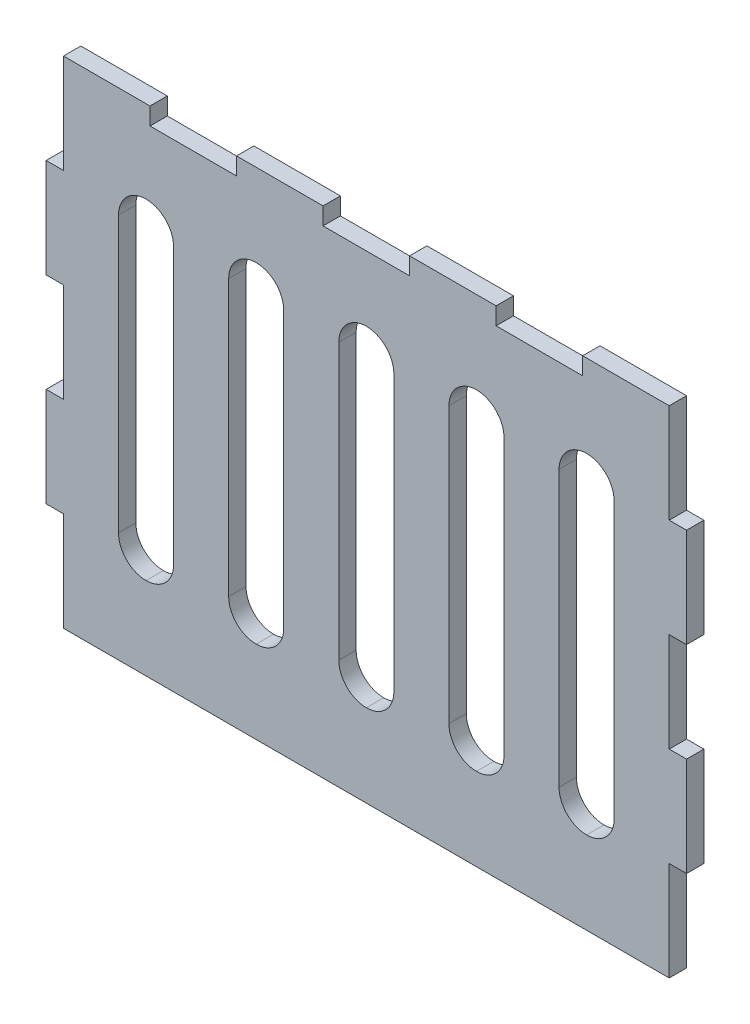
SolidWorks part; units mm, degrees
ref_plane "Front Plane" through (0, 0, 0) normal (0, 0, 1) x (1, 0, 0)
ref_plane "Top Plane" through (0, 0, 0) normal (0, 1, 0) x (1, 0, 0)
ref_plane "Right Plane" through (0, 0, 0) normal (1, 0, 0) x (0, 0, -1)
sketch "Sketch1" plane through (0, 0, 0) normal (0, 0, 1) x (1, 0, 0)
  line L0 (-391.1979, -45.72) -> (-391.1979, -137.16)
  line L1 (-375.1979, 228.6) -> (-295.3693, 228.6)
  line L2 (-375.1979, 228.6) -> (-375.1979, 137.16)
  line L3 (-375.1979, -228.6) -> (183.6021, -228.6)
  line L4 (183.6021, 228.6) -> (183.6021, 137.16)
  line L5 (-375.1979, 0) -> (183.6021, 0) construction
  line L6 (-171.9979, -152.4) -> (-171.9979, 152.4)
  line L7 (-375.1979, 137.16) -> (-391.1979, 137.16)
  line L8 (-375.1979, -137.16) -> (-375.1979, -228.6)
  line L9 (-375.1979, 45.72) -> (-391.1979, 45.72)
  line L10 (-391.1979, 137.16) -> (-391.1979, 45.72)
  line L11 (-375.1979, -45.72) -> (-391.1979, -45.72)
  line L12 (-375.1979, -137.16) -> (-391.1979, -137.16)
  line L13 (-375.1979, 45.72) -> (-375.1979, -45.72)
  line L14 (-324.3979, -152.4) -> (-273.5979, -152.4)
  line L15 (199.6021, -45.72) -> (199.6021, -137.16)
  line L16 (183.6021, -137.16) -> (199.6021, -137.16)
  line L17 (183.6021, -45.72) -> (199.6021, -45.72)
  line L18 (183.6021, 45.72) -> (199.6021, 45.72)
  line L19 (183.6021, 137.16) -> (199.6021, 137.16)
  line L20 (199.6021, 137.16) -> (199.6021, 45.72)
  line L21 (183.6021, 45.72) -> (183.6021, -45.72)
  line L22 (183.6021, -137.16) -> (183.6021, -228.6)
  line L23 (-135.7122, 228.6) -> (-135.7122, 212.6)
  line L24 (-55.8836, 228.6) -> (23.945, 228.6)
  line L25 (-295.3693, 228.6) -> (-295.3693, 212.6)
  line L26 (-295.3693, 212.6) -> (-215.5407, 212.6)
  line L27 (-215.5407, 228.6) -> (-215.5407, 212.6)
  line L28 (-55.8836, 228.6) -> (-55.8836, 212.6)
  line L29 (-135.7122, 212.6) -> (-55.8836, 212.6)
  line L30 (23.945, 228.6) -> (23.945, 212.6)
  line L31 (103.7735, 228.6) -> (103.7735, 212.6)
  line L32 (23.945, 212.6) -> (103.7735, 212.6)
  line L33 (-215.5407, 228.6) -> (-135.7122, 228.6)
  line L34 (103.7735, 228.6) -> (183.6021, 228.6)
  line L35 (-324.3979, -152.4) -> (-324.3979, 152.4)
  line L36 (-324.3979, 152.4) -> (-273.5979, 152.4)
  line L37 (-273.5979, -152.4) -> (-273.5979, 152.4)
  line L38 (-222.7979, -152.4) -> (-171.9979, -152.4)
  line L39 (-222.7979, -152.4) -> (-222.7979, 152.4)
  line L40 (-222.7979, 152.4) -> (-171.9979, 152.4)
  line L41 (-70.3979, -152.4) -> (-70.3979, 152.4)
  line L42 (-121.1979, -152.4) -> (-70.3979, -152.4)
  line L43 (-121.1979, -152.4) -> (-121.1979, 152.4)
  line L44 (-121.1979, 152.4) -> (-70.3979, 152.4)
  line L45 (31.2021, -152.4) -> (31.2021, 152.4)
  line L46 (-19.5979, -152.4) -> (31.2021, -152.4)
  line L47 (-19.5979, -152.4) -> (-19.5979, 152.4)
  line L48 (-19.5979, 152.4) -> (31.2021, 152.4)
  line L49 (132.8021, -152.4) -> (132.8021, 152.4)
  line L50 (82.0021, -152.4) -> (132.8021, -152.4)
  line L51 (82.0021, -152.4) -> (82.0021, 152.4)
  line L52 (82.0021, 152.4) -> (132.8021, 152.4)
  point P0 (-81.1161, 0)
extrude "Boss-Extrude1" add sketch "Sketch1" along normal blind 16
fillet "Fillet1" radius 25.4 20 edges at (-273.5979, 152.4, 8) (-171.9979, 152.4, 8) (-70.3979, 152.4, 8) (31.2021, 152.4, 8) (132.8021, 152.4, 8) (82.0021, 152.4, 8) (-19.5979, 152.4, 8) (-121.1979, 152.4, 8) (-222.7979, 152.4, 8) (-324.3979, 152.4, 8) (-324.3979, -152.4, 8) (-222.7979, -152.4, 8) (-121.1979, -152.4, 8) (-19.5979, -152.4, 8) (82.0021, -152.4, 8) (-273.5979, -152.4, 8) (-171.9979, -152.4, 8) (-70.3979, -152.4, 8) (31.2021, -152.4, 8) (132.8021, -152.4, 8)
equation "\"height\"= 18in"
equation "\"width\"= 22in"
equation "\"material thickness\"= 16mm"
equation "\"D1@Sketch1\"=\"height\""
equation "\"D2@Sketch1\"=\"width\""
equation "\"D1@Boss-Extrude1\"=\"material thickness\""
equation "\"D3@Sketch1\"=\"height\"/5"
equation "\"D4@Sketch1\"=\"height\"/5"
equation "\"D6@Sketch1\"=\"width\"/7"
equation "\"D7@Sketch1\"=\"width\"/7"
equation "\"D9@Sketch1\"=\"material thickness\""
equation "\"D10@Sketch1\"=\"material thickness\""
